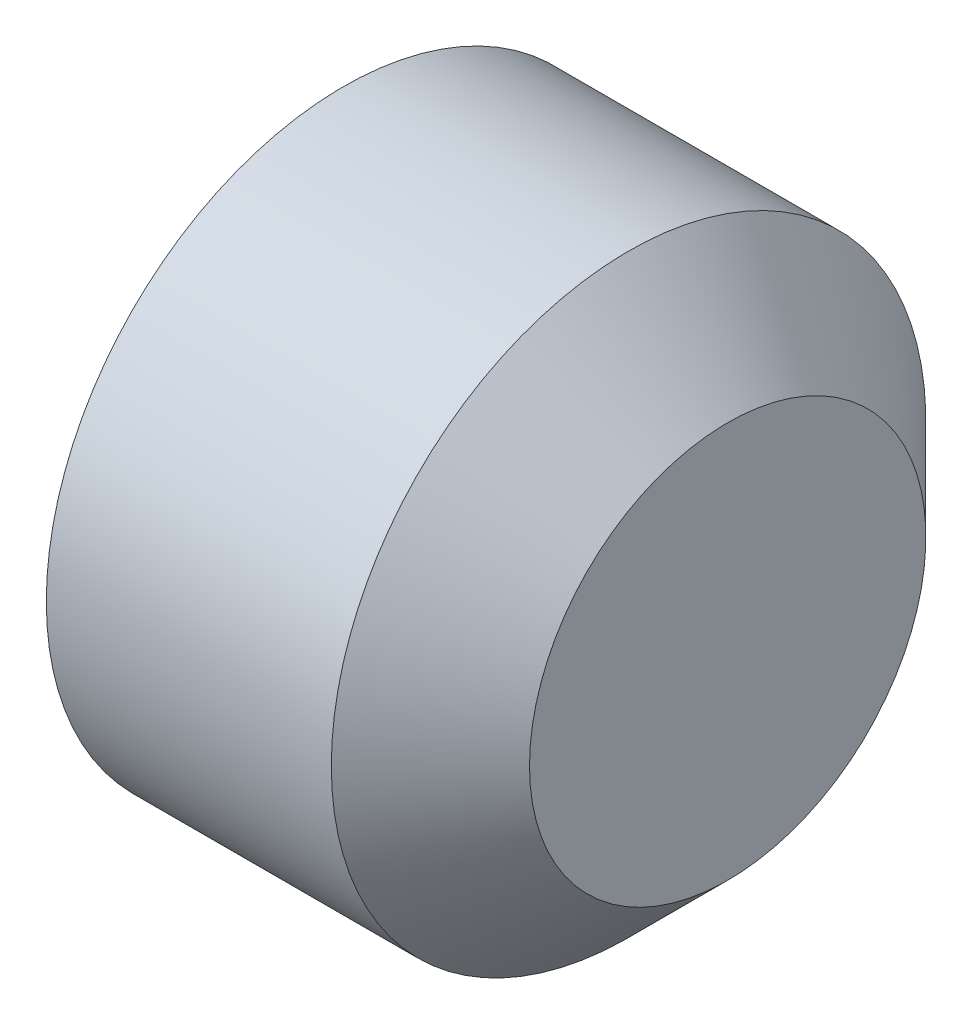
SolidWorks part; units mm, degrees
ref_plane "Plane1" through (0, 0, 0) normal (0, 0, 1) x (1, 0, 0)
ref_plane "Plane2" through (0, 0, 0) normal (0, 1, 0) x (1, 0, 0)
ref_plane "Plane3" through (0, 0, 0) normal (1, 0, 0) x (0, 0, -1)
sketch "BodySke" plane through (0, 0, 0) normal (0, 0, 1) x (1, 0, 0)
  line L0 (0, 0) -> (0, 1.2195)
  line L1 (0, 1.2195) -> (0.1619, 1.5)
  line L2 (0.1619, 1.5) -> (1.6, 1.5)
  line L3 (1.6, 1.5) -> (2.1, 1)
  line L4 (2.1, 0) -> (0, 0)
  line L5 (-12.7, 0) -> (88.9, 0) construction
  line L6 (2.1, 1) -> (2.1, 0)
  line L7 (2.1, 1) -> (2.1, 10.525) construction
  line L8 (0, -1.2195) -> (0.1619, -1.5) construction
  line L9 (0.5, 15.875) -> (0.5, -3.175) construction
  line L10 (1.6, -1.5) -> (2.1, -1) construction
  dimension "Length" = 2.1
  dimension "Diameter" = 3
  dimension "Drive_ch_ang" = 60
  dimension "Minor_dia" = 2.439
  dimension "Cup_nose_ang" = 45
  dimension "Cup_dia" = 2
  dimension "Advance" = 0.5
revolve "BaseBody" add sketch "BodySke" angle 360 about L5
sketch "Sketch2" plane through (0, 0, 0) normal (-1, 0, 0) x (0, 0, 1)
  line L0 (0.433, 0.75) -> (-0.433, 0.75)
  line L1 (-0.433, 0.75) -> (-0.866, 0)
  line L2 (0.433, 0.75) -> (0.866, 0)
  line L3 (0.433, -0.75) -> (0.866, 0)
  line L4 (0.433, -0.75) -> (-0.433, -0.75)
  line L5 (-0.433, -0.75) -> (-0.866, 0)
  dimension "Hex_size" = 1.5
  dimension "D2" = 0.75
  dimension "D3" = 0.75
extrude "Hex" cut sketch "Sketch2" against normal blind 1.2
sketch "Sketch4" plane through (0, 4.7709, -0.5249) normal (-1, 0, 0) x (0, 0, 1)
  line L0 (0.5249, -4.7709) -> (1.3124, -4.7709)
  line L1 (0.5249, -4.7709) -> (6.6732, -1.2211) construction
  line L2 (0.5249, -4.7709) -> (0.9186, -4.0889)
  line L3 (1.153, -4.6137) -> (1.2782, -4.5415)
  line L4 (0.975, -4.3054) -> (1.1002, -4.2332)
  arc A0 (1.153, -4.6137) -> (0.975, -4.3054) centre (0.5249, -4.7709) ccw
  arc A1 (1.3124, -4.7709) -> (1.2782, -4.5415) centre (0.5249, -4.7709) ccw
  arc A2 (0.9186, -4.0889) -> (1.1002, -4.2332) centre (0.5249, -4.7709) cw
  circle A3 centre (0.5249, -4.7709) radius 0.6475 construction
  circle A4 centre (0.5249, -4.7709) radius 0.7875 construction
  dimension "D1" = 30
  dimension "Spline_n_dim" = 1.295
  dimension "Spline_m_dim" = 1.575
  dimension "Spline_a_dim" = 60
  dimension "D3" = 0.178
  dimension "Spline_p_dim" = 0.356
extrude "Spline6" [suppressed] cut sketch "Sketch4" against normal blind 1.1
pattern_circular "CirPattern1" [suppressed] count 6 every 60 about axis through (-12.7, 0, 0) along (1, 0, 0)
sketch "Sketch5" plane through (0, 0.6556, 6.6316) normal (-1, 0, 0) x (0, 0, 1)
  line L0 (-6.6316, -0.6556) -> (-5.8441, -0.6556)
  line L1 (-6.6316, -0.6556) -> (-1.6115, 4.3645) construction
  line L2 (-6.6316, -0.6556) -> (-6.6316, 0.1319)
  line L3 (-6.0479, -0.3236) -> (-5.9633, -0.239)
  line L4 (-6.2996, -0.0719) -> (-6.215, 0.0127)
  line L5 (-6.2996, -0.0719) -> (-6.0479, -0.3236)
  arc A1 (-5.8441, -0.6556) -> (-5.9633, -0.239) centre (-6.6316, -0.6556) ccw
  arc A2 (-6.6316, 0.1319) -> (-6.215, 0.0127) centre (-6.6316, -0.6556) cw
  circle A3 centre (-6.6316, -0.6556) radius 0.6475 construction
  circle A4 centre (-6.6316, -0.6556) radius 0.7875 construction
  dimension "D1" = 45
  dimension "Spline_n_dim" = 1.295
  dimension "Spline_m_dim" = 1.575
  dimension "Spline_a_dim" = 90
  dimension "D3" = 0.178
  dimension "Spline_p_dim" = 0.356
extrude "Spline4" [suppressed] cut sketch "Sketch5" against normal blind 1.1
pattern_circular "CirPattern2" [suppressed] count 4 every 90 about axis through (-12.7, 0, 0) along (1, 0, 0)
sketch "ThdSchSke" plane through (0, 0, 0) normal (0, 0, 1) x (1, 0, 0)
  line L0 (0.1619, -1.2195) -> (-0.0345, -1.5)
  line L1 (0.1619, -1.2195) -> (0.3584, -1.5)
  line L2 (0.3584, -1.5) -> (0.3584, -1.875)
  line L3 (-3.175, 0) -> (5.1513, 0) construction
  line L4 (0.1619, 1.5) -> (0.1619, -1.5) construction
  line L5 (0.3584, -1.875) -> (-0.0345, -1.875)
  line L6 (-0.0345, -1.875) -> (-0.0345, -1.5)
  dimension "Thread_minor" = 2.439
  dimension "Diameter" = 3
  dimension "SideAngle" = 55
  dimension "VeeAngle" = 70
  dimension "Overcut" = 3.75
revolve "ThreadSchematic" [suppressed] cut sketch "ThdSchSke" angle 360 about L3
pattern_linear "ThdSchPat" [suppressed]
equation "\"D2@Sketch2\" = \"Hex_size@Sketch2\" / 2"
equation "\"D3@Sketch2\" = \"Hex_size@Sketch2\" / 2"
equation "\"Thread_minor@ThreadCosmetic\" = \"Minor_dia@BodySke\""
equation "\"D1@Sketch4\" = \"Spline_a_dim@Sketch4\" / 2"
equation "\"D3@Sketch4\" = \"Spline_p_dim@Sketch4\" / 2"
equation "\"D2@CirPattern1\" = \"Spline_a_dim@Sketch4\""
equation "\"Num_teeth@CirPattern1\" = 360 / \"D2@CirPattern1\""
equation "\"Spline_a_dim@Sketch5\" = 90"
equation "\"Spline_p_dim@Sketch5\" = \"Spline_p_dim@Sketch4\""
equation "\"Spline_m_dim@Sketch5\" = \"Spline_m_dim@Sketch4\""
equation "\"Spline_n_dim@Sketch5\" = \"Spline_n_dim@Sketch4\""
equation "\"D1@Sketch5\" = \"Spline_a_dim@Sketch5\" / 2"
equation "\"D3@Sketch5\" = \"Spline_p_dim@Sketch5\" / 2"
equation "\"Key_eng@Spline4\" = \"Key_eng@Spline6\""
equation "\"Thread_minor@ThdSchSke\" = \"Thread_minor@ThreadCosmetic\""
equation "\"Diameter@ThdSchSke\" = \"Diameter@BodySke\""
equation "\"Overcut@ThdSchSke\" = \"Diameter@BodySke\" * 1.25"
equation "\"Num_threads@ThdSchPat\" = int( (\"Length@BodySke\" - ( ( ( \"Diameter@BodySke\" - \"Minor_dia@BodySke\" ) * 0.5 ) / tan( \"Drive_ch_ang@BodySke\" * 0.017453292 ) ) - ( ( ( \"Diameter@BodySke\" - \"Cup_dia@BodySk"
equation "\"Advance@ThdSchPat\" = (\"Length@BodySke\" - ( ( ( \"Diameter@BodySke\" - \"Minor_dia@BodySke\" ) * 0.5 ) / tan( \"Drive_ch_ang@BodySke\" * 0.017453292 ) ) - ( ( ( \"Diameter@BodySke\" - \"Cup_dia@BodySke\" ) * 0."
equation "' \"Num_threads@ThdSchPat\" = \"Num_threads@ThdSchPat\" - sgn( \"Num_threads@ThdSchPat\" - 1) '---chamfered tips only---"
